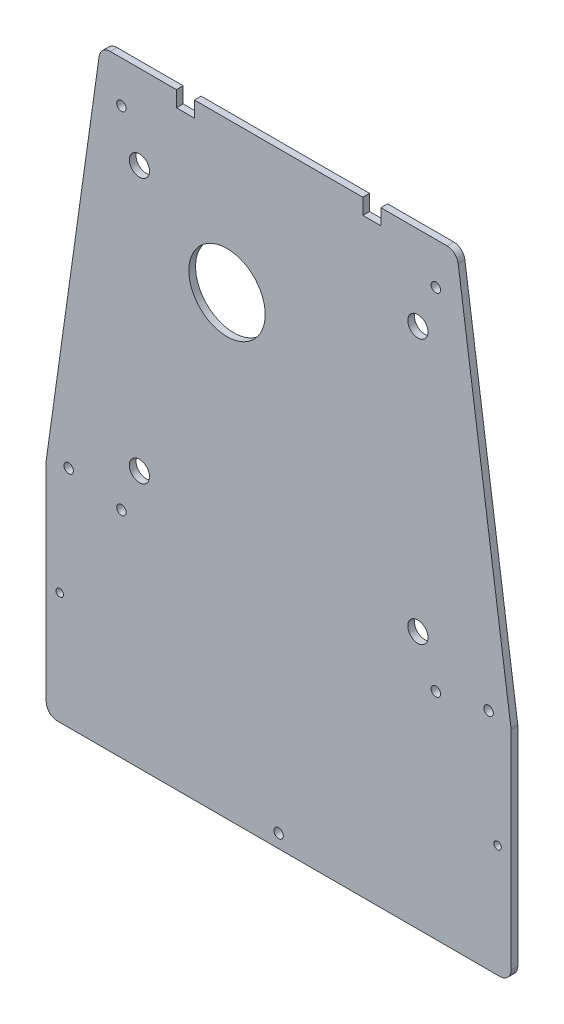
SolidWorks part; units mm, degrees
ref_plane "Plan de face" through (0, 0, 0) normal (0, 0, 1) x (1, 0, 0)
ref_plane "Plan de dessus" through (0, 0, 0) normal (0, 1, 0) x (1, 0, 0)
ref_plane "Plan de droite" through (0, 0, 0) normal (1, 0, 0) x (0, 0, -1)
sketch "Esquisse1" plane through (0, 0, 0) normal (0, 0, 1) x (1, 0, 0)
  line L0 (0, 96.4) -> (0, -128.9462) construction
  line L1 (37.5, 96.4) -> (-37.5, 96.4)
  line L2 (-79.9319, 92.0959) -> (-103.4513, -75.2538)
  line L3 (-103.5, -75.9496) -> (-103.5, -168.6)
  line L4 (-98.5, -173.6) -> (98.5, -173.6)
  line L5 (-45.5, 96.4) -> (-45.5, 89.4)
  line L6 (-45.5, 89.4) -> (-37.5, 89.4)
  line L7 (-37.5, 89.4) -> (-37.5, 96.4)
  line L8 (-45.5, 96.4) -> (-74.9805, 96.4)
  line L9 (45.5, 96.4) -> (74.9805, 96.4)
  line L10 (37.5, 89.4) -> (37.5, 96.4)
  line L11 (45.5, 89.4) -> (37.5, 89.4)
  line L12 (45.5, 96.4) -> (45.5, 89.4)
  line L13 (103.5, -75.9496) -> (103.5, -168.6)
  line L14 (79.9319, 92.0959) -> (103.4513, -75.2538)
  circle A0 centre (-22.994, 29.4) radius 17
  arc A1 (-74.9805, 96.4) -> (-79.9319, 92.0959) centre (-74.9805, 91.4) ccw
  arc A2 (-103.4513, -75.2538) -> (-103.5, -75.9496) centre (-98.5, -75.9496) ccw
  arc A3 (-103.5, -168.6) -> (-98.5, -173.6) centre (-98.5, -168.6) ccw
  circle A4 centre (-62, 58.9) radius 4.5
  circle A5 centre (-62, -58.9) radius 4.5
  circle A6 centre (-70, 77.9) radius 2.1
  circle A7 centre (-70, -77.9) radius 2.1
  circle A8 centre (-93.5, -73.6) radius 2.1
  circle A9 centre (93.5, -73.6) radius 2.1
  circle A10 centre (70, -77.9) radius 2.1
  circle A11 centre (70, 77.9) radius 2.1
  circle A12 centre (62, -58.9) radius 4.5
  circle A13 centre (62, 58.9) radius 4.5
  arc A14 (103.5, -168.6) -> (98.5, -173.6) centre (98.5, -168.6) cw
  arc A15 (103.4513, -75.2538) -> (103.5, -75.9496) centre (98.5, -75.9496) cw
  arc A16 (74.9805, 96.4) -> (79.9319, 92.0959) centre (74.9805, 91.4) cw
  circle A17 centre (0, -167.6) radius 2.1
  point P18 (-103.5, -75.6)
  point P21 (-103.5, -173.6)
  point P62 (0, -173.6)
  dimension "D6" = 34
  dimension "D10" = 5
  dimension "D11" = 9
  dimension "D12" = 9
  dimension "D13" = 4.2
  dimension "D14" = 4.2
  dimension "D15" = 4.2
  dimension "D18" = 4.2
  dimension "D1" = 207
  dimension "D2" = 98
  dimension "D3" = 8
  dimension "D4" = 270
  dimension "D7" = 8
  dimension "D8" = 7
  dimension "D9" = 75
  dimension "D16" = 10
  dimension "D17" = 100
  dimension "D19" = 6
extrude "Extrusion1" add sketch "Esquisse1" along normal blind 3
hole_wizard "Trou taraudé M4x0.71" positions "Esquisse3" profile "Esquisse2" tap size "M4x0.7" standard "ISO"
sketch "Esquisse3" plane through (0, 0, 3) normal (0, 0, 1) x (1, 0, 0)
  line L1 (-103.5, -75.9496) -> (-103.5, -168.6) construction
  line L2 (-98.5, -173.6) -> (98.5, -173.6) construction
  point P1 (-97.5, -123.6)
  point P3 (97.5, -123.6)
  dimension "D1" = 195
  dimension "D2" = 6
  dimension "D3" = 50
sketch "Esquisse2" plane through (-97.5, -123.6, 3) normal (1, 0, 0) x (0, -1, 0)
  line L0 (0, 0) -> (0, 11.0914)
  line L1 (0, 11.0914) -> (1.65, 10.1)
  line L2 (1.65, 10.1) -> (1.65, 0)
  line L5 (1.65, 0) -> (0, 0)
  line L10 (0, 11.0914) -> (-1.65, 10.1) construction
  line L11 (0, -6.35) -> (0, 107.95) construction
  dimension "Diamètre du trou pour taraudage" = 3.3
  dimension "Profondeur du trou pour taraudage" = 10.1
  dimension "Angle de pointe" = 118
